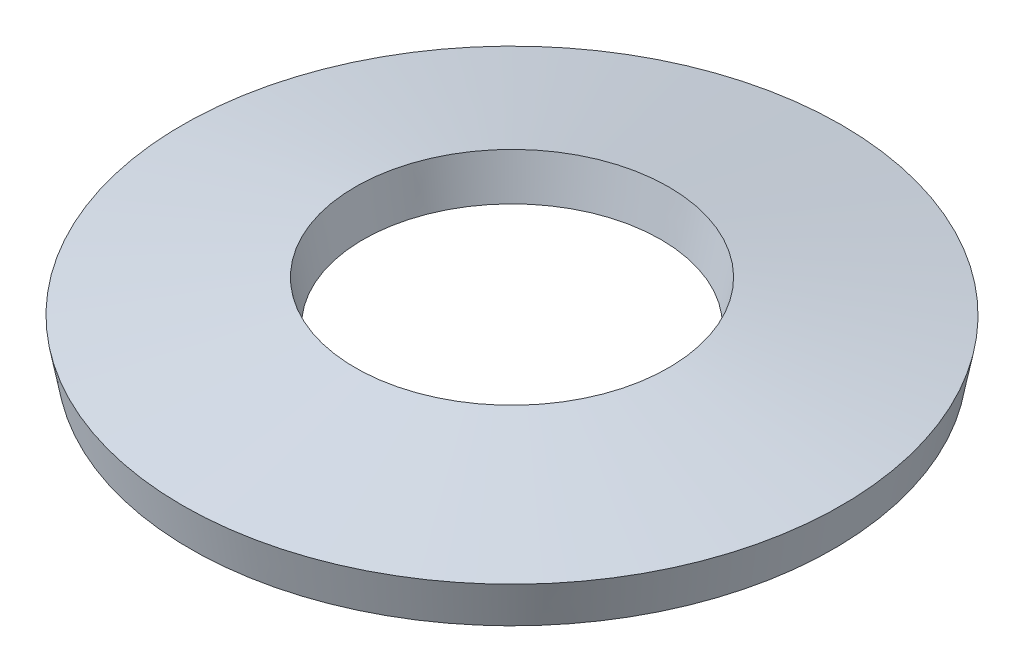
SolidWorks part; units mm, degrees
ref_plane "Front" through (0, 0, 0) normal (0, 0, 1) x (1, 0, 0)
ref_plane "Top" through (0, 0, 0) normal (0, 1, 0) x (1, 0, 0)
ref_plane "Right" through (0, 0, 0) normal (1, 0, 0) x (0, 0, -1)
sketch "Sketch1" plane through (0, 0, 0) normal (0, 0, 1) x (1, 0, 0)
  line L0 (3.4772, 1.651) -> (7.3126, 0.9233)
  line L1 (7.3126, 0.9233) -> (7.1374, 0)
  line L3 (7.1374, 0) -> (3.302, 0.7277)
  line L4 (3.302, 0.7277) -> (3.4772, 1.651)
  line L5 (0, 0) -> (0, 10.9318) construction
  dimension "D1" = 6.604
  dimension "D2" = 14.2748
  dimension "D3" = 0.9398
  dimension "D4" = 1.651
revolve "Revolve1" add sketch "Sketch1" angle 360 about L5
